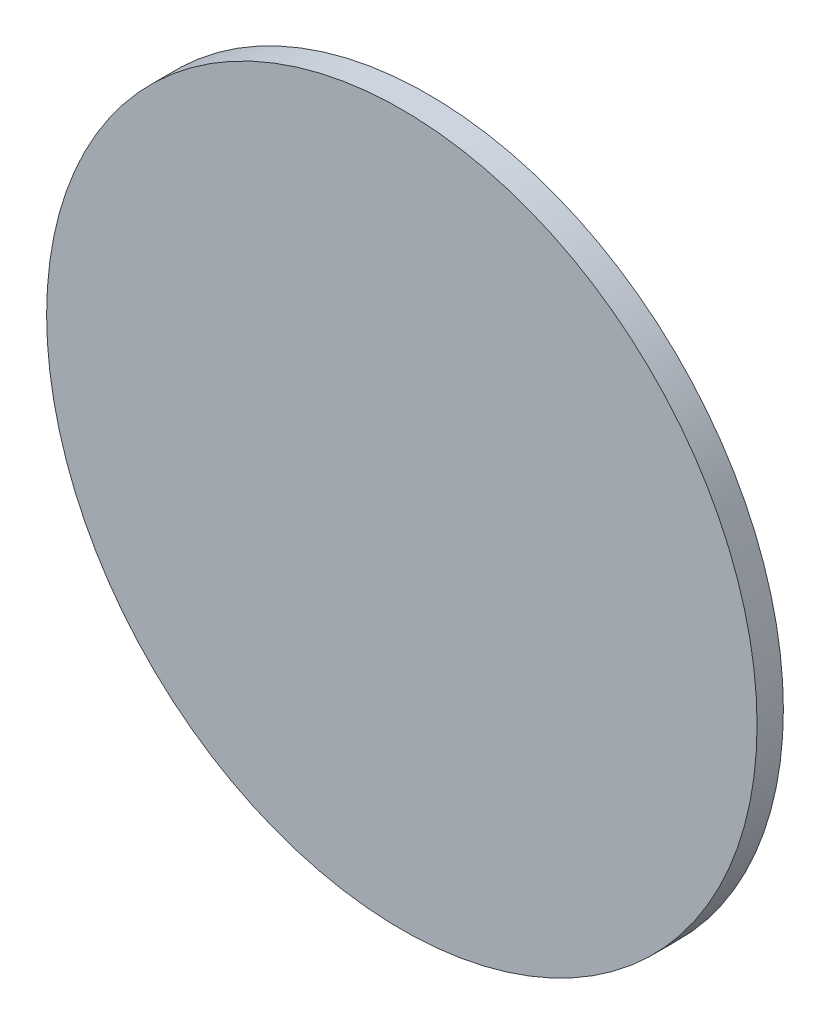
SolidWorks part; units mm, degrees
ref_plane "Plan de face" through (0, 0, 0) normal (0, 0, 1) x (1, 0, 0)
ref_plane "Plan de dessus" through (0, 0, 0) normal (0, 1, 0) x (1, 0, 0)
ref_plane "Plan de droite" through (0, 0, 0) normal (1, 0, 0) x (0, 0, -1)
sketch "Esquisse1" plane through (0, 0, 0) normal (0, 0, 1) x (1, 0, 0)
  circle A0 centre (0, 0) radius 13.5
  dimension "D1" = 27
extrude "Extrusion1" add sketch "Esquisse1" along normal blind 1
